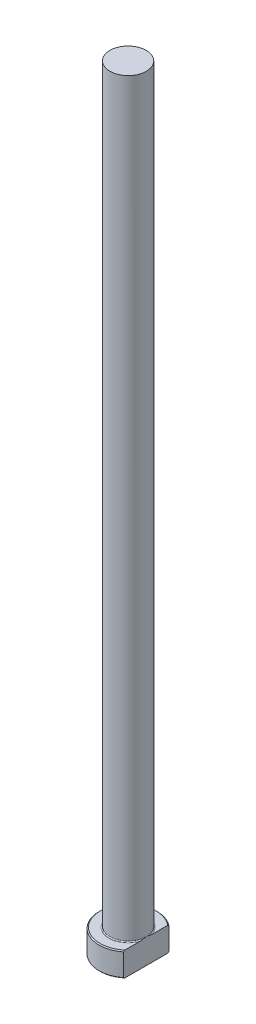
SolidWorks part; units mm, degrees
ref_plane "Front Plane" through (0, 0, 0) normal (0, 0, 1) x (1, 0, 0)
ref_plane "Top Plane" through (0, 0, 0) normal (0, 1, 0) x (1, 0, 0)
ref_plane "Right Plane" through (0, 0, 0) normal (1, 0, 0) x (0, 0, -1)
sketch "Sketch1" plane through (0, 0, 0) normal (0, 0, 1) x (1, 0, 0)
  line L0 (0, 259.9588) -> (0, -15.1925) construction
  line L1 (0, 0) -> (-6, 0)
  line L2 (-6, 0) -> (-6, 5)
  line L3 (-6, 5) -> (-3.75, 5)
  line L4 (-3.75, 5) -> (-3.75, 160)
  line L5 (-3.75, 160) -> (0, 160)
  line L6 (0, 160) -> (0, 0)
  dimension "L" = 160
  dimension "H" = 12
  dimension "T" = 5
  dimension "D" = 7.5
revolve "Revolve1" add sketch "Sketch1" angle 360 about L0
chamfer "Chamfer1" distance 0.2 angle 45 2 edges at (0, 5, 6) (0, 0, 6)
fillet "Fillet1" radius 0.2 1 edges at (0, 5, 3.75)
sketch "Sketch2" plane through (0, 0, 0) normal (0, 1, 0) x (1, 0, 0)
  line L0 (3.75, 4.6837) -> (3.75, -4.6837)
  circle A0 centre (0, 0) radius 6 construction
  arc A1 (3.75, -4.6837) -> (3.75, 4.6837) centre (0, 0) ccw
  circle A2 centre (0, 0) radius 3.75 construction
extrude "KEY" cut sketch "Sketch2" along normal through all
